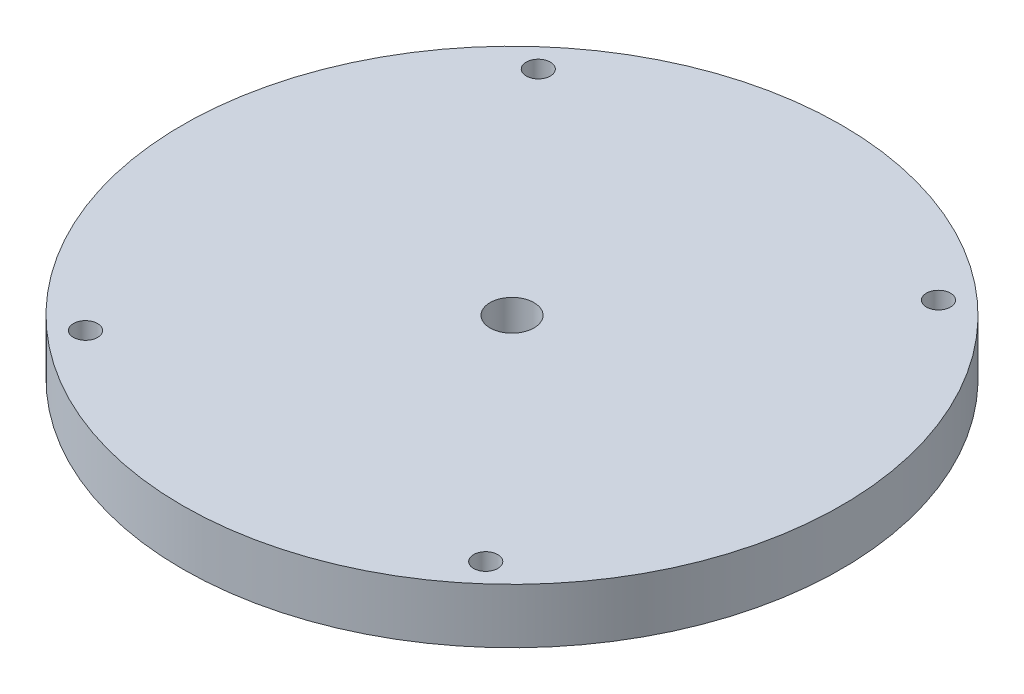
SolidWorks part; units mm, degrees
ref_plane "Front Plane" through (0, 0, 0) normal (0, 0, 1) x (1, 0, 0)
ref_plane "Top Plane" through (0, 0, 0) normal (0, 1, 0) x (1, 0, 0)
ref_plane "Right Plane" through (0, 0, 0) normal (1, 0, 0) x (0, 0, -1)
sketch "Sketch1" plane through (0, 0, 0) normal (0, 1, 0) x (1, 0, 0)
  line L0 (0, 0) -> (0, 60.0569) construction
  line L1 (0, 0) -> (0, -60.0569) construction
  line L2 (0, 0) -> (60.0569, 0) construction
  line L3 (0, 0) -> (-60.0569, 0) construction
  line L4 (0, 0) -> (-39.7723, 45) construction
  line L5 (0, 0) -> (39.7723, 45) construction
  line L6 (0, 0) -> (-39.7723, -45) construction
  line L7 (0, 0) -> (39.7723, -45) construction
  line L8 (-36.4297, 41.218) -> (36.4297, 41.218) construction
  line L9 (36.4297, 41.218) -> (36.4297, -41.218) construction
  line L10 (36.4297, -41.218) -> (-36.4297, -41.218) construction
  circle A0 centre (0, 0) radius 60
  circle A1 centre (0, 0) radius 4
  circle A9 centre (-36.4297, 41.218) radius 2.2
  circle A10 centre (36.4297, 41.218) radius 2.2
  circle A11 centre (-36.4297, -41.218) radius 2.2
  circle A12 centre (36.4297, -41.218) radius 2.2
  dimension "D1" = 45
extrude "Boss-Extrude1" add sketch "Sketch1" along normal blind 10
